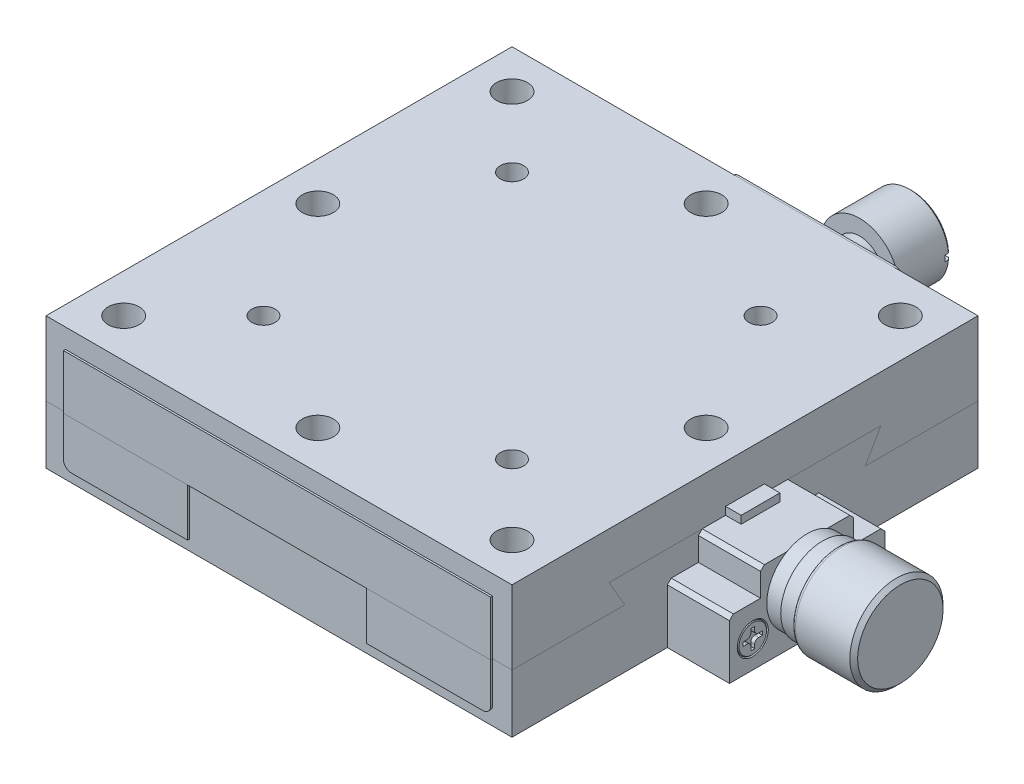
SolidWorks part; units mm, degrees
ref_plane "Front Plane" through (0, 0, 0) normal (0, 0, 1) x (1, 0, 0)
ref_plane "Top Plane" through (0, 0, 0) normal (0, 1, 0) x (1, 0, 0)
ref_plane "Right Plane" through (0, 0, 0) normal (1, 0, 0) x (0, 0, -1)
sketch "Sketch1" plane through (0, 0, 0) normal (0, 0, 1) x (1, 0, 0)
  line L0 (-17.5553, 0) -> (22.6305, 0) construction
  line L1 (-30, 8.5) -> (30, 8.5)
  line L2 (-30, 8.5) -> (-30, -8.5)
  line L3 (-30, -8.5) -> (30, -8.5)
  line L4 (30, 8.5) -> (30, -8.5)
  line L5 (0, 11.3249) -> (0, -12.2184) construction
  dimension "D1" = 60
  dimension "D2" = 17
extrude "Extrude1" add sketch "Sketch1" against normal mid plane 60
sketch "Sketch3" plane through (-30, 0, 0) normal (-1, 0, 0) x (0, 0, 1)
  line L0 (-30, -1) -> (-15.4793, -1)
  line L2 (-15.4793, -1) -> (-17.5, 2.5)
  line L3 (-17.5, 2.5) -> (17.5, 2.5)
  line L4 (17.5, 2.5) -> (15.4793, -1)
  line L5 (15.4793, -1) -> (30, -1)
  line L7 (0, 9.2862) -> (0, -8.8555) construction
  line L9 (-30, -8.5) -> (30, -8.5) construction
  line L10 (-30, 8.5) -> (-30, -8.5) construction
  line L11 (30, 8.5) -> (30, -8.5) construction
  dimension "D1" = 35
  dimension "D2" = 3.5
  dimension "D3" = 60
  dimension "D4" = 7.5
split "Split1" trim tools "Sketch3" resulting bodies 102 103
sketch "Sketch4" plane through (30, 0, 0) normal (1, 0, 0) x (0, 0, -1)
  line L0 (-10, -8.5) -> (-10, -1)
  line L1 (-30, -1) -> (-15.4793, -1) construction
  line L2 (-10, -1) -> (-6, -1)
  line L3 (-6, -1) -> (-6, 2.5)
  line L4 (-6, 2.5) -> (6, 2.5)
  line L5 (6, 2.5) -> (6, -1)
  line L6 (6, -1) -> (10, -1)
  line L7 (15.4793, -1) -> (30, -1) construction
  line L8 (10, -1) -> (10, -8.5)
  line L9 (10, -8.5) -> (-10, -8.5)
  line L10 (0, 10.5069) -> (0, -9.7219) construction
  line L12 (-17.5, 2.5) -> (17.5, 2.5) construction
  line L13 (30, -8.5) -> (-30, -8.5) construction
  dimension "D1" = 12
  dimension "D2" = 20
extrude "Extrude2" add sketch "Sketch4" along normal blind 8 separate body
sketch "Sketch5" plane through (0, 0, 0) normal (0, 0, 1) x (1, 0, 0)
  line L0 (-16.9557, -2) -> (34.9975, -2) construction
  line L1 (38, -2) -> (38, 3.2)
  line L2 (38, 3.2) -> (40, 3.2)
  line L3 (40, 3.2) -> (40, 3.4)
  line L4 (42, 3.4) -> (42, 3.5)
  line L5 (42.5, 4) -> (49.5, 4)
  line L6 (50, 3.5) -> (50, -2)
  line L7 (38, -1) -> (38, -8.5) construction
  line L8 (30, -8.5) -> (30, -1) construction
  line L10 (-30, -8.5) -> (30, -8.5) construction
  line L11 (49.5, 4) -> (50, 3.5)
  line L12 (38, 2.5) -> (30, 2.5) construction
  line L13 (40, 3.4) -> (42, 3.4)
  line L14 (38, -2) -> (50, -2)
  arc A0 (42, 3.5) -> (42.5, 4) centre (42.5, 3.5) cw
  point P17 (50, 4)
  dimension "D4" = 0.5
  dimension "D1" = 20
  dimension "D2" = 12
  dimension "D3" = 6.5
  dimension "D6" = 0.5
  dimension "D5" = 2
  dimension "D7" = 0.7
  dimension "D8" = 0.2
revolve "Revolve1" add sketch "Sketch5" angle 360 about L0
ref_plane "Plane1" through (0, 0, 25) normal (0, 0, 1) x (1, 0, 0)
sketch "Sketch7" plane through (0, 0, 25) normal (0, 0, 1) x (1, 0, 0)
  line L0 (0, 10.5598) -> (0, -0.7863) construction
  line L1 (30, 8.5) -> (-30, 8.5) construction
  line L2 (0, 8.5) -> (2, 8.5)
  line L3 (0, 8.5) -> (0, 1.2983)
  line L4 (-0.3822, 2.5) -> (1.4322, 2.5) construction
  line L5 (2, 8.5) -> (2, 2.5)
  line L6 (2, 2.5) -> (0, 1.2983)
  dimension "D1" = 59
  dimension "D2" = 6
  dimension "D3" = 4
revolve "Cut-Revolve1" cut sketch "Sketch7" angle 360 about L0
pattern_linear "LPattern1" count 2 spacing 25 along (1, 0, 0) count 2 spacing 25 along (-1, 0, 0) of "Cut-Revolve1"
pattern_linear "LPattern2" count 2 spacing 50 along (0, 0, -1) of "LPattern1", "Cut-Revolve1"
sketch "Sketch8" plane through (0, 0, 0) normal (0, 0, 1) x (1, 0, 0)
  line L0 (-25, 8.7759) -> (-25, -1.8346) construction
  line L1 (30, 8.5) -> (-30, 8.5) construction
  line L2 (-25, 8.5) -> (-23, 8.5)
  line L3 (-25, 8.5) -> (-25, 1.2983)
  line L4 (-25, 1.2983) -> (-23, 2.5)
  line L5 (-23, 8.5) -> (-23, 2.5)
  line L6 (30, 2.5) -> (-30, 2.5) construction
  dimension "D2" = 4
  dimension "D3" = 25
  dimension "D4" = 59
revolve "Cut-Revolve2" cut sketch "Sketch8" angle 360 about L0
pattern_linear "LPattern3" count 2 spacing 50 along (1, 0, 0) of "Cut-Revolve2"
sketch "Sketch9" plane through (0, 2.5, 0) normal (0, 1, 0) x (-1, 0, 0)
  line L0 (-30, -30) -> (-30, 30) construction
  line L1 (-32, -2.5) -> (-30, -2.5)
  line L2 (-32, -2.5) -> (-32, 2.5)
  line L3 (-32, 2.5) -> (-30, 2.5)
  line L4 (-30, -2.5) -> (-30, 2.5)
  line L5 (-17.8737, 0) -> (-1.2554, 0) construction
  dimension "D1" = 5
  dimension "D2" = 2
extrude "Extrude3" add sketch "Sketch9" along normal blind 1 separate body
ref_plane "Plane2" through (10, 0, 0) normal (1, 0, 0) x (0, 0, -1)
sketch "Sketch10" plane through (10, 0, 0) normal (1, 0, 0) x (0, 0, -1)
  line L0 (-16.0871, 2) -> (16.1877, 2) construction
  line L1 (30, -8.5) -> (-30, -8.5) construction
  line L2 (30.25, 4.98) -> (33.25, 4.98)
  line L3 (30, -8.5) -> (30, -1) construction
  line L4 (33.25, 4.98) -> (33.25, 5.03)
  line L5 (33.25, 5.03) -> (34.75, 5.03)
  line L6 (34.75, 5.03) -> (34.75, 7)
  line L7 (34.75, 7) -> (41.2, 7)
  line L8 (41.5, 6.7) -> (41.5, 2)
  line L9 (41.5, 2) -> (30, 2)
  line L10 (30.25, 2.98) -> (30.25, 4.98)
  line L11 (41.2, 7) -> (41.5, 6.7)
  line L12 (30, -1) -> (30, 8.5) construction
  line L13 (30.25, 2.98) -> (30, 2.98)
  line L14 (30, 2.98) -> (30, 2)
  point P16 (41.5, 7)
  dimension "D1" = 10.5
  dimension "D2" = 10
  dimension "D3" = 11.5
  dimension "D4" = 0.25
  dimension "D5" = 1.5
  dimension "D6" = 0.98
  dimension "D7" = 0.05
  dimension "D8" = 2
  dimension "D10" = 0.3
  dimension "D9" = 3
revolve "Revolve2" add sketch "Sketch10" angle 360 about L0
sketch "Sketch11" plane through (10, 0, 0) normal (1, 0, 0) x (0, 0, -1)
  line L0 (41.5, -2.7) -> (41.5, 6.7) construction
  line L1 (40.75, 2.375) -> (41.5, 2.375)
  line L2 (40.75, 2.375) -> (40.75, 1.625)
  line L3 (40.75, 1.625) -> (41.5, 1.625)
  line L4 (41.5, 2.375) -> (41.5, 1.625)
  line L5 (10.1527, 2) -> (21.4889, 2) construction
  line L6 (-16.0871, 2) -> (16.1877, 2) construction
  dimension "D1" = 0.75
  dimension "D2" = 0.75
extrude "Cut-Extrude2" cut sketch "Sketch11" against normal mid plane 11.5
sketch "Sketch12" plane through (0, 0, 25) normal (0, 0, 1) x (1, 0, 0)
  line L0 (-25, 0.5868) -> (-25, -12.2814) construction
  line L1 (-25, -1) -> (-21, -1)
  line L2 (-30, -1) -> (30, -1) construction
  line L3 (-21, -1) -> (-21, -6)
  line L4 (-21, -6) -> (-22.75, -6)
  line L5 (-22.75, -6) -> (-22.75, -8.5)
  line L6 (-30, -8.5) -> (30, -8.5) construction
  line L7 (-22.75, -8.5) -> (-25, -8.5)
  line L8 (-25, -8.5) -> (-25, -1)
  dimension "D1" = 25
  dimension "D2" = 4.5
  dimension "D3" = 8
  dimension "D4" = 2.5
revolve "Cut-Revolve3" cut sketch "Sketch12" angle 360 about L0
pattern_linear "LPattern4" count 2 spacing 50 along (0, 0, -1) count 2 spacing 50 along (1, 0, 0) of "Cut-Revolve3"
sketch "Sketch13" plane through (0, 0, 30) normal (0, 0, 1) x (1, 0, 0)
  line L0 (-27.5, -6.15) -> (-27.5, -1)
  line L2 (27.5, -1) -> (27.5, -6.15)
  line L4 (-27.5, -1) -> (27.5, -1)
  line L6 (-30, -1) -> (30, -1) construction
  line L8 (26.5, -7.15) -> (-26.5, -7.15)
  line L11 (0, 14.0975) -> (0, -10.6657) construction
  arc A0 (-27.5, -6.15) -> (-26.5, -7.15) centre (-26.5, -6.15) ccw
  arc A1 (26.5, -7.15) -> (27.5, -6.15) centre (26.5, -6.15) ccw
  point P24 (-27.5, -7.15)
  dimension "D3" = 1
  dimension "D1" = 6.15
  dimension "D2" = 55
extrude "Extrude4" add sketch "Sketch13" along normal blind 0.25 separate body
sketch "Sketch14" plane through (0, 0, -30) normal (0, 0, -1) x (-1, 0, 0)
  line L0 (30, -8.5) -> (-30, -8.5) construction
  line L2 (2, -7.5) -> (2, 7.5)
  line L3 (-30, 8.5) -> (30, 8.5) construction
  line L4 (1, 8.5) -> (-19, 8.5)
  line L5 (-20, 7.5) -> (-20, -7.5)
  line L6 (-30, -1) -> (-30, 8.5) construction
  line L7 (-17.5, 3) -> (-0.5, 3)
  line L8 (-18, 2.5) -> (-18, 1.5)
  line L9 (-17.5, 1) -> (-0.5, 1)
  line L10 (0, 2.5) -> (0, 1.5)
  line L11 (-9, 14.1335) -> (-9, -6.1072) construction
  line L12 (-14.0826, 2) -> (7.454, 2) construction
  line L13 (-19, -8.5) -> (1, -8.5)
  arc A0 (-20, -7.5) -> (-19, -8.5) centre (-19, -7.5) ccw
  arc A1 (-19, 8.5) -> (-20, 7.5) centre (-19, 7.5) ccw
  arc A2 (2, 7.5) -> (1, 8.5) centre (1, 7.5) ccw
  arc A3 (2, -7.5) -> (1, -8.5) centre (1, -7.5) cw
  arc A5 (-17.5, 3) -> (-18, 2.5) centre (-17.5, 2.5) ccw
  arc A6 (-18, 1.5) -> (-17.5, 1) centre (-17.5, 1.5) ccw
  arc A7 (-0.5, 1) -> (0, 1.5) centre (-0.5, 1.5) ccw
  arc A8 (-0.5, 3) -> (0, 2.5) centre (-0.5, 2.5) cw
  point P20 (-20, 8.5)
  point P23 (2, 8.5)
  point P32 (-18, 3)
  point P39 (0, 3)
  point P40 (-20, -8.5)
  point P43 (2, -8.5)
  dimension "D5" = 1
  dimension "D6" = 0.5
  dimension "D9" = 1
  dimension "D1" = 10
  dimension "D2" = 22
  dimension "D4" = 18
  dimension "D7" = 2
  dimension "D8" = 10.5
extrude "Extrude6" add sketch "Sketch14" along normal blind 0.25 separate body
sketch "Sketch26" plane through (0, 0, 30) normal (0, 0, 1) x (1, 0, 0)
  line L0 (27.5, -6.15) -> (27.5, -1) construction
  line L1 (-27.5, -1) -> (27.5, -1)
  line L2 (-27.5, -1) -> (-27.5, 6)
  line L3 (-27.5, 6) -> (27.5, 6)
  line L4 (27.5, -1) -> (27.5, 6)
  dimension "D1" = 7
extrude "Extrude9" add sketch "Sketch26" along normal blind 0.25 separate body
sketch "Sketch15" plane through (38, 0, 0) normal (1, 0, 0) x (0, 0, -1)
  line L0 (0, 12.9894) -> (0, -12.6202) construction
  circle A0 centre (-7, -5) radius 2
  circle A1 centre (7, -5) radius 2
  dimension "D1" = 4
  dimension "D2" = 14
  dimension "D3" = 5
extrude "Cut-Extrude3" cut sketch "Sketch15" against normal blind 2
sketch "Sketch16" plane through (36, 0, 0) normal (1, 0, 0) x (0, 0, -1)
  circle A0 centre (-7, -5) radius 1.875
  circle A1 centre (-7, -5) radius 2 construction
  dimension "D1" = 3.75
extrude "Extrude7" add sketch "Sketch16" along normal blind 2 separate body
chamfer "Chamfer1" distance 0.1 angle 45 1 edges at (38, -3.125, 7)
sketch "Sketch17" plane through (38, 0, 0) normal (1, 0, 0) x (0, 0, -1)
  line L0 (-7, -2.6113) -> (-7, -5.3425) construction
  line L1 (-9.4433, -5) -> (-6.9033, -5) construction
  line L2 (-8.25, -5.25) -> (-8.25, -4.75)
  line L3 (-8.25, -4.75) -> (-7.25, -4.75)
  line L4 (-7.25, -4.75) -> (-7.25, -3.75)
  line L5 (-7.25, -3.75) -> (-6.75, -3.75)
  line L6 (-6.75, -3.75) -> (-6.75, -4.75)
  line L7 (-6.75, -4.75) -> (-5.75, -4.75)
  line L8 (-5.75, -4.75) -> (-5.75, -5.25)
  line L9 (-5.75, -5.25) -> (-6.75, -5.25)
  line L10 (-6.75, -5.25) -> (-6.75, -6.25)
  line L11 (-6.75, -6.25) -> (-7.25, -6.25)
  line L12 (-7.25, -6.25) -> (-7.25, -5.25)
  line L13 (-7.25, -5.25) -> (-8.25, -5.25)
  dimension "D1" = 0.5
  dimension "D2" = 7
  dimension "D3" = 2.5
  dimension "D4" = 2.5
  dimension "D5" = 0.5
  dimension "D6" = 5
extrude "Cut-Extrude4" cut sketch "Sketch17" against normal blind 0.5
fillet "Fillet2" radius 0.5 4 edges at (37.75, -5.25, 6.75) (37.75, -5.25, 7.25) (37.75, -4.75, 7.25) (37.75, -4.75, 6.75)
pattern_linear "LPattern5" count 2 spacing 14 along (0, 0, -1)
sketch "Sketch18" plane through (0, 0, -30.25) normal (0, 0, -1) x (-1, 0, 0)
  line L0 (-10, 10.7386) -> (-10, -9.8413) construction
  line L1 (-19, -8.5) -> (1, -8.5) construction
  circle A0 centre (-15, -6) radius 1.5
  circle A1 centre (-5, -6) radius 1.5
  dimension "D2" = 3
  dimension "D1" = 10
  dimension "D3" = 2.5
  dimension "D4" = 10
extrude "Extrude8" add sketch "Sketch18" along normal blind 1.2 separate body
fillet "Fillet1" radius 0.5 1 edges at (13.5, -6, -31.45)
fillet "Fillet3" radius 0.5 1 edges at (3.5, -6, -31.45)
sketch "Sketch19" plane through (0, 0, -31.45) normal (0, 0, -1) x (-1, 0, 0)
  line L0 (-8.4281, -6) -> (-5.6071, -6) construction
  line L1 (-15.125, -5) -> (-14.875, -5)
  line L2 (-14.875, -5) -> (-14.875, -5.875)
  line L3 (-14.875, -5.875) -> (-14, -5.875)
  line L4 (-14, -5.875) -> (-14, -6.125)
  line L5 (-14, -6.125) -> (-14.875, -6.125)
  line L6 (-14.875, -6.125) -> (-14.875, -7)
  line L7 (-14.875, -7) -> (-15.125, -7)
  line L8 (-15.125, -7) -> (-15.125, -6.125)
  line L9 (-15.125, -6.125) -> (-16, -6.125)
  line L10 (-16, -6.125) -> (-16, -5.875)
  line L11 (-16, -5.875) -> (-15.125, -5.875)
  line L12 (-15.125, -5.875) -> (-15.125, -5)
  line L13 (-15, 2.5) -> (-15, 0.5) construction
  line L14 (-5.125, -6.125) -> (-5.125, -7)
  line L15 (-19, -8.5) -> (1, -8.5) construction
  line L16 (-4.875, -6.125) -> (-4.875, -7)
  line L17 (-5, -2.5823) -> (-5, -6.9988) construction
  line L20 (-6, -5.875) -> (-5.125, -5.875)
  line L21 (-6, -5.875) -> (-6, -6.125)
  line L22 (-6, -6.125) -> (-5.125, -6.125)
  line L24 (-4, -5.875) -> (-4.875, -5.875)
  line L25 (-4, -5.875) -> (-4, -6.125)
  line L26 (-4, -6.125) -> (-4.875, -6.125)
  line L28 (-5.125, -5) -> (-4.875, -5)
  line L29 (-5.125, -5) -> (-5.125, -5.875)
  line L30 (-5.125, -7) -> (-4.875, -7)
  line L31 (-4.875, -5) -> (-4.875, -5.875)
  dimension "D1" = 2
  dimension "D2" = 0.25
  dimension "D3" = 15
  dimension "D4" = 2.5
  dimension "D5" = 2
  dimension "D6" = 10
extrude "Cut-Extrude5" cut sketch "Sketch19" against normal blind 0.25
sketch "Sketch21" plane through (0, 0, 30.25) normal (0, 0, 1) x (1, 0, 0)
  line L0 (-27.5, -1) -> (27.5, -1)
  line L3 (-27.5, -1) -> (-27.5, -6.15) construction
  line L4 (27.5, -6.15) -> (27.5, -1) construction
  line L5 (-30, -8.5) -> (30, -8.5) construction
  dimension "D1" = 7.5
sketch "Sketch22" plane through (0, 0, 30.25) normal (0, 0, 1) x (1, 0, 0)
  line L0 (27.5, -1) -> (-27.5, -1) construction
  line L1 (-11.5, -1) -> (11.5, -1)
  line L2 (-11.5, -1) -> (-11.5, -7.5)
  line L3 (-11.5, -7.5) -> (11.5, -7.5)
  line L4 (11.5, -1) -> (11.5, -7.5)
  line L6 (0, 0) -> (0, 12.5984) construction
  dimension "D1" = 23
  dimension "D2" = 6.5
ref_plane "Plane3" through (0, 0, -16) normal (0, 0, 1) x (1, 0, 0)
sketch "Sketch24" plane through (0, 0, -16) normal (0, 0, 1) x (1, 0, 0)
  line L0 (-16, 11.9255) -> (-16, -1.458) construction
  line L1 (-16, 8.5) -> (-14.5, 8.5)
  line L2 (30, 8.5) -> (-30, 8.5) construction
  line L3 (-14.5, 8.5) -> (-14.5, 2.5)
  line L4 (-16, 1.5987) -> (-14.5, 2.5)
  line L5 (-16, 1.5987) -> (-16, 8.5)
  dimension "D1" = 16
  dimension "D2" = 3
  dimension "D3" = 6
  dimension "D4" = 59
revolve "Cut-Revolve4" cut sketch "Sketch24" angle 360 about L0
pattern_linear "LPattern8" count 2 spacing 32 along (0, 0, 1) count 2 spacing 32 along (1, 0, 0) of "Cut-Revolve4"
chamfer "Chamfer2" distance 0.5 angle 45 4 edges at (34, 2.5, 6) (34, 2.5, -6) (34, -1, -10) (34, -1, 10)
extrude "Cut-Extrude7" cut sketch "Sketch22" against normal up to next
ref_plane "Plane4" through (0, 0, -30.25) normal (0, 0, -1) x (-1, 0, 0)
sketch "Sketch27" plane through (0, 0, -30.25) normal (0, 0, -1) x (-1, 0, 0)
  line L0 (-10, 10.7386) -> (-10, -9.8413) construction
  circle A0 centre (-10, -6) radius 1.5
  circle A2 centre (-15, -6) radius 1.5 construction
extrude "Extrude10" add sketch "Sketch27" along normal blind 1.2 separate body
fillet "Fillet4" radius 0.5 1 edges at (8.5, -6, -31.45)
sketch "Sketch28" plane through (0, 0, -31.45) normal (0, 0, -1) x (-1, 0, 0)
  line L0 (-10, -12.0546) -> (-10, -10.5424) construction
  line L1 (-10.125, -5) -> (-9.875, -5)
  line L2 (-10.125, -5) -> (-10.125, -5.875)
  line L3 (-10.125, -7) -> (-9.875, -7)
  line L4 (-9.875, -5) -> (-9.875, -5.875)
  line L5 (-11, -5.875) -> (-10.125, -5.875)
  line L6 (-11, -5.875) -> (-11, -6.125)
  line L7 (-11, -6.125) -> (-10.125, -6.125)
  line L8 (-9, -5.875) -> (-9, -6.125)
  line L9 (-10, 10.7386) -> (-10, -9.8413) construction
  line L10 (-12.7132, -6) -> (-7.1636, -6) construction
  line L11 (-9.875, -6.125) -> (-9, -6.125)
  line L12 (-10.125, -6.125) -> (-10.125, -7)
  line L13 (-9.875, -6.125) -> (-9.875, -7)
  line L14 (-9.875, -5.875) -> (-9, -5.875)
  line L17 (-14.875, -7) -> (-15.125, -7) construction
  line L18 (-15.125, -5) -> (-14.875, -5) construction
  line L19 (-14.875, -5.875) -> (-14, -5.875) construction
  line L20 (-16, -5.875) -> (-15.125, -5.875) construction
extrude "Cut-Extrude8" cut sketch "Sketch28" against normal blind 0.5
sketch "草圖1" plane through (-30, 0, 0) normal (-1, 0, 0) x (0, 0, 1)
  line L0 (-28.75, -2.006) -> (-28.75, -7)
  line L1 (-28.75, -7) -> (-23.7611, -7)
  line L2 (-23.7611, -7) -> (-23.7611, -3.6383)
  line L3 (-23.7611, -3.4844) -> (-23.7611, -2.006)
  line L4 (-17.4631, -4.2325) -> (-17.4631, -5.7186)
  line L5 (-17.4631, -4.2325) -> (-16.9656, -4.2325)
  line L6 (-16.8095, -4.0765) -> (-16.8095, -3.7285)
  line L7 (-16.8095, -3.7285) -> (-18.6114, -3.7285)
  line L8 (-18.6114, -3.7285) -> (-18.6114, -4.2232)
  line L9 (-18.6114, -4.2232) -> (-17.9664, -4.2232)
  line L10 (-17.9664, -4.2232) -> (-17.9664, -5.5598)
  line L11 (-17.8116, -5.7158) -> (-17.4631, -5.7186)
  line L12 (-18.7466, -3.7285) -> (-19.3113, -3.7285)
  line L13 (-20.4779, -3.7285) -> (-21.0418, -3.7285)
  line L14 (-21.1715, -3.7285) -> (-22.223, -3.7285)
  line L15 (-21.0418, -3.7285) -> (-21.0418, -5.7146)
  line L16 (-18.7473, -5.7146) -> (-19.0826, -5.7146)
  line L17 (-19.7487, -5.7146) -> (-20.0405, -5.7146)
  line L18 (-20.7065, -5.7146) -> (-21.0418, -5.7146)
  line L19 (-21.1823, -5.7146) -> (-22.223, -5.7146)
  line L20 (-20.4779, -3.7285) -> (-19.8946, -5.081)
  line L21 (-20.5505, -4.5598) -> (-20.5505, -5.5586)
  line L22 (-20.5505, -4.5598) -> (-20.0405, -5.7146)
  line L23 (-18.7473, -3.7285) -> (-18.7473, -5.7146)
  line L24 (-19.2386, -4.5598) -> (-19.2386, -5.5586)
  line L25 (-19.2386, -4.5598) -> (-19.7487, -5.7146)
  line L26 (-19.3113, -3.7285) -> (-19.8946, -5.081)
  line L27 (-21.1823, -4.4916) -> (-22.1859, -4.4916)
  line L28 (-21.1823, -4.4916) -> (-21.1823, -5.7146)
  line L29 (-22.1859, -4.4916) -> (-22.1859, -4.7592)
  line L30 (-21.6144, -4.9153) -> (-22.0298, -4.9153)
  line L31 (-21.6144, -4.9153) -> (-21.6144, -5.2951)
  line L32 (-21.6144, -5.2951) -> (-22.223, -5.2951)
  line L33 (-21.1715, -3.7285) -> (-21.1715, -3.9767)
  line L34 (-22.223, -4.1328) -> (-21.3275, -4.1328)
  line L35 (-24.6619, -6.2693) -> (-24.037, -4.6819)
  line L36 (-24.037, -4.6819) -> (-24.6, -4.6823)
  line L37 (-24.6, -4.6823) -> (-25.1276, -5.3604)
  line L38 (-23.2169, -3.4282) -> (-23.2169, -3.5725)
  line L39 (-24.6619, -6.2693) -> (-26.1404, -6.2774)
  line L40 (-28.75, -2.006) -> (-23.7611, -2.006)
  line L41 (-28.75, -7) -> (-28.75, -1.9396)
  arc A0 (-16.9656, -4.2325) -> (-16.8095, -4.0765) centre (-16.9656, -4.0765) ccw
  arc A1 (-17.9664, -5.5598) -> (-17.8116, -5.7158) centre (-17.8104, -5.5598) ccw
  arc A2 (-20.7065, -5.7146) -> (-20.5505, -5.5586) centre (-20.7065, -5.5586) ccw
  arc A3 (-19.2386, -5.5586) -> (-19.0826, -5.7146) centre (-19.0826, -5.5586) ccw
  arc A4 (-22.1859, -4.7592) -> (-22.0298, -4.9153) centre (-22.0298, -4.7592) ccw
  arc A5 (-21.3275, -4.1328) -> (-21.1715, -3.9767) centre (-21.3275, -3.9767) ccw
  arc A6 (-22.223, -4.1328) -> (-22.223, -5.2951) centre (-21.8604, -4.714) ccw
  arc A7 (-22.223, -3.7285) -> (-22.223, -5.7146) centre (-22.0535, -4.7216) ccw
  arc A8 (-25.8611, -5.3331) -> (-25.1276, -5.3604) centre (-25.2055, 2.396) ccw
  arc A9 (-26.4614, -5.2531) -> (-25.8611, -5.3331) centre (-25.8322, -2.8245) ccw
  arc A10 (-26.9283, -5.0619) -> (-26.4614, -5.2531) centre (-26.2367, -4.0383) ccw
  arc A11 (-27.0458, -4.8579) -> (-26.9283, -5.0619) centre (-26.8114, -4.8587) ccw
  arc A12 (-26.9718, -4.6893) -> (-27.0458, -4.8579) centre (-26.7255, -4.8981) ccw
  arc A13 (-26.7205, -4.4664) -> (-26.9718, -4.6893) centre (-26.1579, -5.3533) ccw
  arc A14 (-26.3812, -4.2815) -> (-26.7205, -4.4664) centre (-25.2769, -6.7131) ccw
  arc A15 (-26.3812, -4.2815) -> (-25.9599, -4.1154) centre (-29.5802, 4.449) ccw
  arc A16 (-25.9599, -4.1154) -> (-25.5824, -4.0028) centre (-34.8636, 26.4126) ccw
  arc A17 (-25.2079, -3.9045) -> (-25.5824, -4.0028) centre (-24.8668, -5.9672) ccw
  arc A18 (-25.2079, -3.9045) -> (-24.8943, -3.839) centre (-25.5754, -1.3615) ccw
  arc A19 (-24.4933, -3.7615) -> (-24.8943, -3.839) centre (-22.3814, -15.7706) ccw
  arc A20 (-24.4933, -3.7615) -> (-24.1141, -3.6937) centre (-24.8542, -0.6512) ccw
  arc A21 (-24.1141, -3.6937) -> (-23.7771, -3.6422) centre (-24.2433, -1.7187) ccw
  arc A22 (-23.4684, -3.5996) -> (-23.7771, -3.6422) centre (-20.1657, -28.6686) ccw
  arc A23 (-23.2169, -3.5725) -> (-23.4684, -3.5996) centre (-23.1501, -5.3713) ccw
  arc A24 (-26.1404, -6.2774) -> (-26.6363, -6.2338) centre (-30.5397, -53.4381) ccw
  arc A25 (-27.1893, -6.1632) -> (-26.6363, -6.2338) centre (-25.9027, 1.7123) ccw
  arc A26 (-27.9171, -5.9753) -> (-27.1893, -6.1632) centre (-26.385, -1.5434) ccw
  arc A27 (-28.4084, -5.6596) -> (-27.9171, -5.9753) centre (-27.3495, -4.5519) ccw
  arc A28 (-28.5347, -5.3615) -> (-28.4084, -5.6596) centre (-28.1386, -5.3695) ccw
  arc A29 (-28.3733, -4.9721) -> (-28.5347, -5.3615) centre (-27.8545, -5.4153) ccw
  arc A30 (-27.9943, -4.6002) -> (-28.3733, -4.9721) centre (-26.7844, -6.2125) ccw
  arc A31 (-27.5381, -4.3407) -> (-27.9943, -4.6002) centre (-24.9759, -9.3743) ccw
  arc A32 (-27.1028, -4.1434) -> (-27.5381, -4.3407) centre (-25.238, -8.8366) ccw
  arc A33 (-26.7901, -4.0328) -> (-27.1028, -4.1434) centre (-4.3368, -68.0178) ccw
  arc A34 (-26.351, -3.906) -> (-26.7901, -4.0328) centre (-25.4218, -7.9494) ccw
  arc A35 (-25.8886, -3.7889) -> (-26.351, -3.906) centre (-24.553, -10.0343) ccw
  arc A36 (-25.4551, -3.7052) -> (-25.8886, -3.7889) centre (-23.1594, -16.7485) ccw
  arc A37 (-25.4551, -3.7052) -> (-25.0795, -3.634) centre (-25.9766, 0.0714) ccw
  arc A38 (-24.7427, -3.5865) -> (-25.0795, -3.634) centre (-24.6437, -5.507) ccw
  arc A39 (-24.3502, -3.5402) -> (-24.7427, -3.5865) centre (-24.195, -6.5446) ccw
  arc A40 (-24.0019, -3.4952) -> (-24.3502, -3.5402) centre (-23.7223, -7.0307) ccw
  arc A41 (-23.6813, -3.4638) -> (-24.0019, -3.4952) centre (-23.0672, -11.3866) ccw
  arc A42 (-23.8635, -3.48) -> (-23.4514, -3.4415) centre (-26.1407, 23.1071) ccw
  arc A43 (-23.2169, -3.4282) -> (-23.4514, -3.4415) centre (-23.2427, -5.0482) ccw
extrude "除料-伸長1" cut sketch "草圖1" against normal blind 0.02
sketch "草圖2" plane through (-30, 0, 0) normal (-1, 0, 0) x (0, 0, 1)
  line L0 (-30, -1) -> (-15.4793, -1) construction
  line L1 (-28.75, -2.5) -> (-23.75, -2.5)
  line L2 (-28.75, -2.5) -> (-28.75, -7.5)
  line L3 (-28.75, -7.5) -> (-23.75, -7.5)
  line L4 (-23.75, -2.5) -> (-23.75, -7.5)
  line L6 (-30.25, -7.5) -> (-30.25, -4.5) construction
  dimension "D1" = 5
  dimension "D2" = 5
  dimension "D3" = 1.5
  dimension "D4" = 1.5
extrude "除料-伸長2" cut sketch "草圖2" against normal blind 0.01
sketch "草圖3" plane through (-30, 0, 0) normal (-1, 0, 0) x (0, 0, 1)
  line L0 (-13.2032, -5.9) -> (13.2032, -5.9) construction
  line L1 (-30, -8.5) -> (30, -8.5) construction
  line L3 (0, 12.7924) -> (0, 0) construction
  text T0 "<i>MC1A-60</i>" font "Century Gothic" height 2
  dimension "D1" = 2.6
extrude "除料-伸長3" cut sketch "草圖3" against normal blind 0.02
sketch "草圖4" plane through (-30, 0, 0) normal (-1, 0, 0) x (0, 0, 1)
  line L0 (15.2772, -7) -> (28.5, -7) construction
  line L3 (30, -1) -> (30, -8.5) construction
  line L4 (-30, -8.5) -> (30, -8.5) construction
  text T0 "<i>Made in Taiwan</i>" font "Century Gothic" height 1.2
  dimension "D1" = 1.5
  dimension "D2" = 1.5
extrude "除料-伸長4" cut sketch "草圖4" against normal blind 0.02
